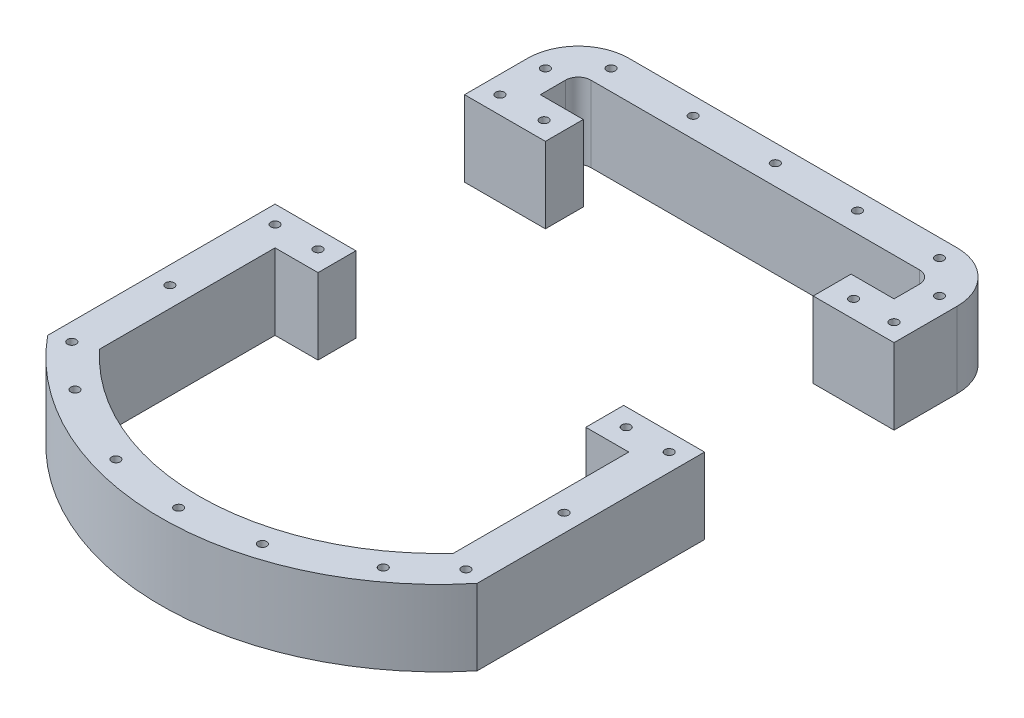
SolidWorks part; units mm, degrees
ref_plane "Front" through (0, 0, 0) normal (0, 0, 1) x (1, 0, 0)
ref_plane "Top" through (0, 0, 0) normal (0, 1, 0) x (1, 0, 0)
ref_plane "Right" through (0, 0, 0) normal (1, 0, 0) x (0, 0, -1)
sketch "Sketch1" plane through (0, 0, 0) normal (0, 1, 0) x (1, 0, 0)
  line L0 (0, 179.8705) -> (0, -170.2797) construction
  line L1 (-65, 145) -> (65, 145)
  line L2 (-85, 125) -> (-85, 100)
  line L4 (85, 125) -> (85, 100)
  line L5 (-65, 130) -> (65, 130)
  line L6 (70, 125) -> (70, 115)
  line L12 (68, 100) -> (85, 100)
  line L13 (68, 100) -> (68, 25)
  line L14 (68, 25) -> (85, 25)
  line L19 (53, 115) -> (70, 115)
  line L20 (-68, 25) -> (-85, 25)
  line L22 (-68, 100) -> (-85, 100)
  line L23 (-68, 100) -> (-68, 25)
  line L24 (85, 25) -> (85, -65)
  line L25 (-128.9167, 62.5) -> (175.707, 62.5) construction
  line L28 (-85, 25) -> (-85, -65)
  line L32 (53, 115) -> (53, 10)
  line L33 (53, 10) -> (70, 10)
  line L34 (70, 10) -> (70, -59.405)
  line L35 (115.1039, 0) -> (-141.1607, 0) construction
  line L37 (-70, 10) -> (-70, -59.405)
  line L41 (-53, 10) -> (-70, 10)
  line L42 (-53, 115) -> (-53, 10)
  line L43 (-53, 115) -> (-70, 115)
  line L44 (-70, 125) -> (-70, 115)
  arc A2 (65, 145) -> (85, 125) centre (65, 125) cw
  arc A3 (-65, 145) -> (-85, 125) centre (-65, 125) ccw
  arc A5 (65, 130) -> (70, 125) centre (65, 125) cw
  arc A24 (85, -65) -> (-85, -65) centre (0, 4.8212) cw
  arc A29 (70, -59.405) -> (-70, -59.405) centre (0, 4.8212) cw
  arc A30 (-65, 130) -> (-70, 125) centre (-65, 125) ccw
  dimension "D3" = 145
  dimension "D4" = 20
  dimension "D5" = 15
  dimension "D22" = 110
  dimension "D2" = 170
  dimension "D6" = 75
  dimension "D8" = 17
  dimension "D21" = 90
extrude "Boss-Extrude1" add sketch "Sketch1" along normal blind 30
sketch "Sketch5" plane through (0, 30, 0) normal (0, 1, 0) x (1, 0, 0)
  line L33 (65, 138) -> (-65, 138)
  line L34 (-78, 125) -> (-78, 107)
  line L35 (-78, 107) -> (-61, 107)
  line L36 (-61, 107) -> (-61, 18)
  line L37 (-61, 18) -> (-78, 18)
  line L38 (-78, 18) -> (-78, -62.4469)
  line L39 (78, -62.4469) -> (78, 18)
  line L40 (78, 18) -> (61, 18)
  line L41 (61, 18) -> (61, 107)
  line L42 (61, 107) -> (78, 107)
  line L43 (78, 107) -> (78, 125)
  line L44 (65, 138) -> (-65, 138)
  line L45 (-78, 125) -> (-78, 107)
  line L46 (-78, 107) -> (-61, 107)
  line L47 (-61, 107) -> (-61, 18)
  line L48 (-61, 18) -> (-78, 18)
  line L49 (-78, 18) -> (-78, -62.4469)
  line L50 (78, -62.4469) -> (78, 18)
  line L51 (78, 18) -> (61, 18)
  line L52 (61, 18) -> (61, 107)
  line L53 (61, 107) -> (78, 107)
  line L54 (78, 107) -> (78, 125)
  arc A9 (78, 125) -> (65, 138) centre (65, 125) ccw
  arc A10 (-65, 138) -> (-78, 125) centre (-65, 125) ccw
  arc A11 (-78, -62.4469) -> (78, -62.4469) centre (0, 4.8212) ccw
  arc A12 (78, 125) -> (65, 138) centre (65, 125) ccw
  arc A13 (-65, 138) -> (-78, 125) centre (-65, 125) ccw
  arc A14 (-78, -62.4469) -> (78, -62.4469) centre (0, 4.8212) ccw
  dimension "D1" = 7
sketch "Sketch6" plane through (0, 30, 0) normal (0, 1, 0) x (1, 0, 0)
  circle A0 centre (-65, 138) radius 1.5
  dimension "D1" = 3
sketch "Sketch8" plane through (0, 0, 0) normal (0, -1, 0) x (1, 0, 0)
  line L0 (38, -131.2907) -> (38, -86.1747) construction
  line L3 (65, -145) -> (-65, -145) construction
  line L4 (68, -25) -> (68, -100) construction
  circle A0 centre (38, -115) radius 1.5
  dimension "D1" = 3
  dimension "D2" = 30
  dimension "D3" = 30
sketch "Sketch10" plane through (0, 30, 0) normal (0, 1, 0) x (1, 0, 0)
  line L0 (53, 10) -> (53, 115) construction
  line L1 (68, 25) -> (53, 25)
  line L2 (68, 25) -> (68, 100)
  line L3 (68, 100) -> (53, 100)
  line L4 (53, 25) -> (53, 100)
  line L5 (-68, 100) -> (-68, 25) construction
  line L6 (-68, 25) -> (-53, 25)
  line L7 (-68, 25) -> (-68, 100)
  line L8 (-68, 100) -> (-53, 100)
  line L9 (-53, 25) -> (-53, 100)
  line L10 (-53, 115) -> (-53, 10) construction
  line L11 (-85, 100) -> (-68, 100) construction
  line L12 (68, 100) -> (85, 100) construction
  line L13 (-68, 25) -> (-85, 25) construction
extrude "Cut-Extrude1" cut sketch "Sketch10" against normal up to next
sketch "Sketch11" plane through (0, 30, 0) normal (0, 1, 0) x (1, 0, 0)
  line L0 (53, 107) -> (78, 107) construction
  line L1 (78, 107) -> (78, 125) construction
  line L2 (65, 138) -> (-65, 138) construction
  line L3 (-78, 125) -> (-78, 107) construction
  line L4 (-78, 107) -> (-53, 107) construction
  line L5 (0, 163.1826) -> (0, 117.007) construction
  line L6 (65, 130) -> (-65, 130) construction
  line L12 (53, 115) -> (53, 100)
  line L13 (53, 100) -> (85, 100)
  line L14 (85, 100) -> (85, 125)
  line L15 (65, 145) -> (-65, 145)
  line L16 (-85, 125) -> (-85, 100)
  line L17 (-85, 100) -> (-53, 100)
  line L18 (-53, 100) -> (-53, 115)
  line L19 (-53, 115) -> (-70, 115)
  line L20 (-70, 115) -> (-70, 125)
  line L21 (-65, 130) -> (65, 130)
  line L22 (70, 125) -> (70, 115)
  line L23 (70, 115) -> (53, 115)
  line L25 (53, 100) -> (85, 100) construction
  line L26 (85, 100) -> (85, 125) construction
  line L27 (65, 145) -> (-65, 145) construction
  line L28 (-85, 125) -> (-85, 100) construction
  line L29 (-85, 100) -> (-53, 100) construction
  line L43 (0, 0) -> (0, -177.356) construction
  line L47 (78, 18) -> (53, 18)
  line L48 (78, -62.4469) -> (78, 18)
  line L49 (-78, 18) -> (-78, -62.4469)
  line L50 (-53, 18) -> (-78, 18)
  line L51 (78, 18) -> (53, 18) construction
  line L52 (78, -62.4469) -> (78, 18) construction
  line L53 (-78, 18) -> (-78, -62.4469) construction
  line L54 (-53, 18) -> (-78, 18) construction
  circle A0 centre (-60.5, 107) radius 1.7
  circle A1 centre (-78, 125) radius 1.7
  circle A2 centre (-65, 138) radius 1.7
  circle A3 centre (-32.5, 138) radius 1.7
  circle A4 centre (32.5, 138) radius 1.7
  circle A5 centre (65, 138) radius 1.7
  circle A6 centre (78, 125) radius 1.7
  circle A7 centre (78, 107) radius 1.7
  circle A8 centre (62, 107) radius 1.7
  circle A9 centre (-78, 107) radius 1.7
  arc A10 (78, 125) -> (65, 138) centre (65, 125) ccw construction
  arc A11 (-65, 138) -> (-78, 125) centre (-65, 125) ccw construction
  circle A12 centre (0, 138) radius 1.7
  arc A14 (85, 125) -> (65, 145) centre (65, 125) ccw
  arc A15 (-65, 145) -> (-85, 125) centre (-65, 125) ccw
  arc A16 (-65, 130) -> (-70, 125) centre (-65, 125) ccw
  arc A17 (70, 125) -> (65, 130) centre (65, 125) ccw
  arc A18 (85, 125) -> (65, 145) centre (65, 125) ccw construction
  arc A19 (-65, 145) -> (-85, 125) centre (-65, 125) ccw construction
  circle A24 centre (-78, 18) radius 1.7
  arc A25 (-78, -62.4469) -> (78, -62.4469) centre (0, 4.8212) ccw
  arc A26 (-78, -62.4469) -> (78, -62.4469) centre (0, 4.8212) ccw construction
  circle A27 centre (-61, 18) radius 1.7
  circle A28 centre (-78, -23.62) radius 1.7
  circle A29 centre (-78, -62.4469) radius 1.7
  circle A30 centre (-61, -78.1728) radius 1.7
  circle A31 centre (0, -98.1788) radius 1.7
  circle A32 centre (-29, -94.012) radius 1.7
  circle A33 centre (61, 18) radius 1.7
  circle A34 centre (78, 18) radius 1.7
  circle A35 centre (78, -23.62) radius 1.7
  circle A36 centre (78, -62.4469) radius 1.7
  circle A37 centre (61, -78.1728) radius 1.7
  circle A38 centre (29, -94.012) radius 1.7
  dimension "D1" = 3.4
  dimension "D8" = 3.4
  dimension "D4" = 32.5
  dimension "D5" = 16
  dimension "D6" = 17.5
  dimension "D3" = 8
  dimension "D9" = 17
  dimension "D10" = 17
  dimension "D11" = 41.62
  dimension "D12" = 29
  dimension "D2" = 0
  dimension "D7" = 7
extrude "Cut-Extrude3" cut sketch "Sketch11" against normal blind 32
other "Save Bodies1"
other "Save Bodies3"
